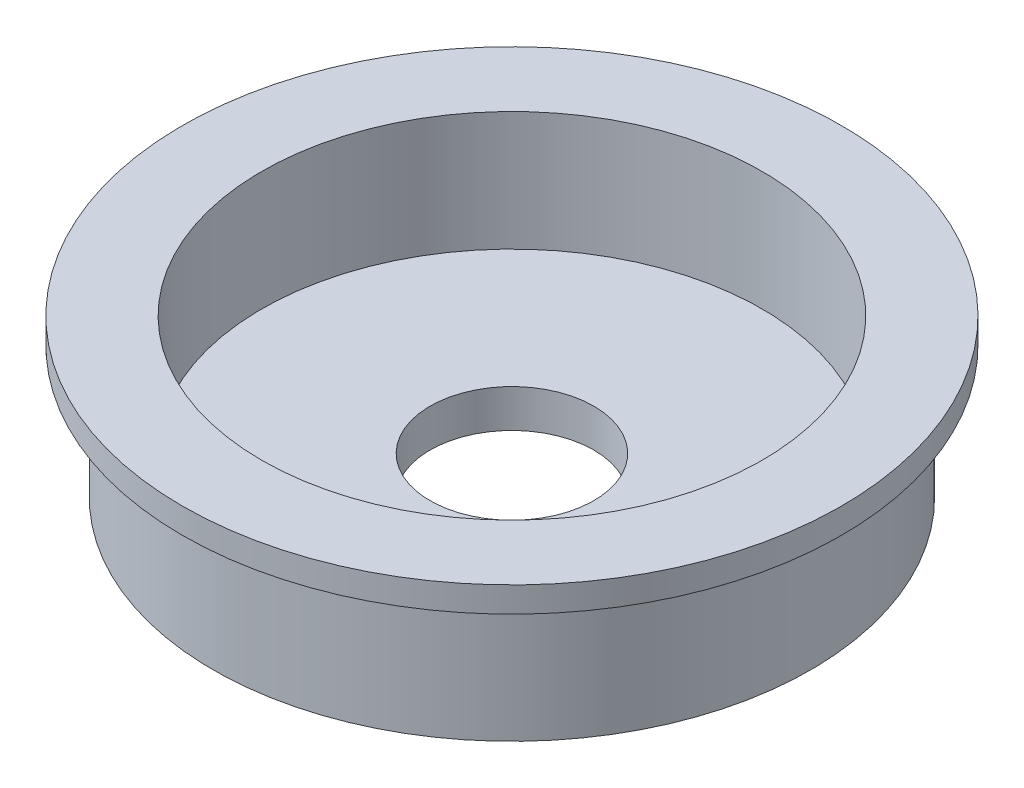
SolidWorks part; units mm, degrees
ref_plane "Front Plane" through (0, 0, 0) normal (0, 0, 1) x (1, 0, 0)
ref_plane "Top Plane" through (0, 0, 0) normal (0, 1, 0) x (1, 0, 0)
ref_plane "Right Plane" through (0, 0, 0) normal (1, 0, 0) x (0, 0, -1)
sketch "Sketch1" plane through (0, 0, 0) normal (0, 1, 0) x (1, 0, 0)
  circle A0 centre (0, 0) radius 14.9733
  circle A1 centre (0, 0) radius 4.1021
  dimension "D1" = 8.2042
  dimension "D2" = 29.9466
extrude "Boss-Extrude1" add sketch "Sketch1" along normal blind 6.604
sketch "Sketch2" plane through (0, 6.604, 0) normal (0, 1, 0) x (1, 0, 0)
  circle A0 centre (0, 0) radius 4.1021
  circle A1 centre (0, 0) radius 16.51
  circle A2 centre (0, 0) radius 4.1021 construction
  dimension "D1" = 33.02
extrude "Boss-Extrude2" add sketch "Sketch2" along normal blind 1.27
sketch "Sketch3" plane through (0, 7.874, 0) normal (0, 1, 0) x (1, 0, 0)
  circle A0 centre (0, 0) radius 12.5349
  dimension "D1" = 25.0698
extrude "Cut-Extrude1" cut sketch "Sketch3" against normal blind 5.969
